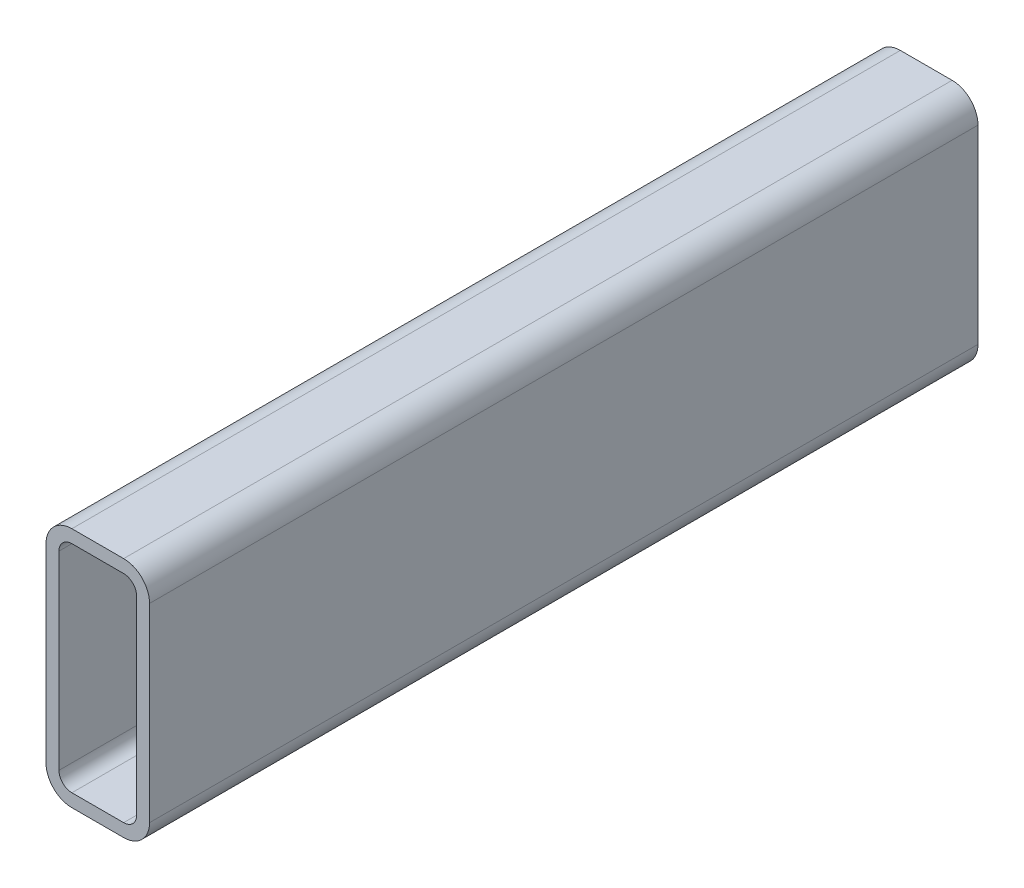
SolidWorks part; units mm, degrees
ref_plane "Front Plane" through (0, 0, 0) normal (0, 0, 1) x (1, 0, 0)
ref_plane "Top Plane" through (0, 0, 0) normal (0, 1, 0) x (1, 0, 0)
ref_plane "Right Plane" through (0, 0, 0) normal (1, 0, 0) x (0, 0, -1)
sketch "Sketch1" plane through (0, 0, 0) normal (0, 0, 1) x (1, 0, 0)
  line B0 (28.575, 88.9) -> (9.525, 88.9)
  arc B1 (38.1, 79.375) -> (28.575, 88.9) centre (28.575, 79.375) ccw
  line B2 (38.1, 9.525) -> (38.1, 79.375)
  arc B3 (28.575, 0) -> (38.1, 9.525) centre (28.575, 9.525) ccw
  line B4 (9.525, 0) -> (28.575, 0)
  arc B5 (0, 9.525) -> (9.525, 0) centre (9.525, 9.525) ccw
  line B6 (0, 79.375) -> (0, 9.525)
  arc B7 (9.525, 88.9) -> (0, 79.375) centre (9.525, 79.375) ccw
  line B8 (9.525, 84.1375) -> (28.575, 84.1375)
  arc B9 (33.3375, 79.375) -> (28.575, 84.1375) centre (28.575, 79.375) ccw
  line B10 (33.3375, 79.375) -> (33.3375, 9.525)
  arc B11 (28.575, 4.7625) -> (33.3375, 9.525) centre (28.575, 9.525) ccw
  line B12 (28.575, 4.7625) -> (9.525, 4.7625)
  arc B13 (4.7625, 9.525) -> (9.525, 4.7625) centre (9.525, 9.525) ccw
  line B14 (4.7625, 9.525) -> (4.7625, 79.375)
  arc B15 (9.525, 84.1375) -> (4.7625, 79.375) centre (9.525, 79.375) ccw
sketch_block_instance "HSS3.5x1.5x0.1875-1"
sketch_block "HSS3.5x1.5x0.1875"
extrude "Boss-Extrude1" add sketch "Sketch1" along normal blind 304.8
